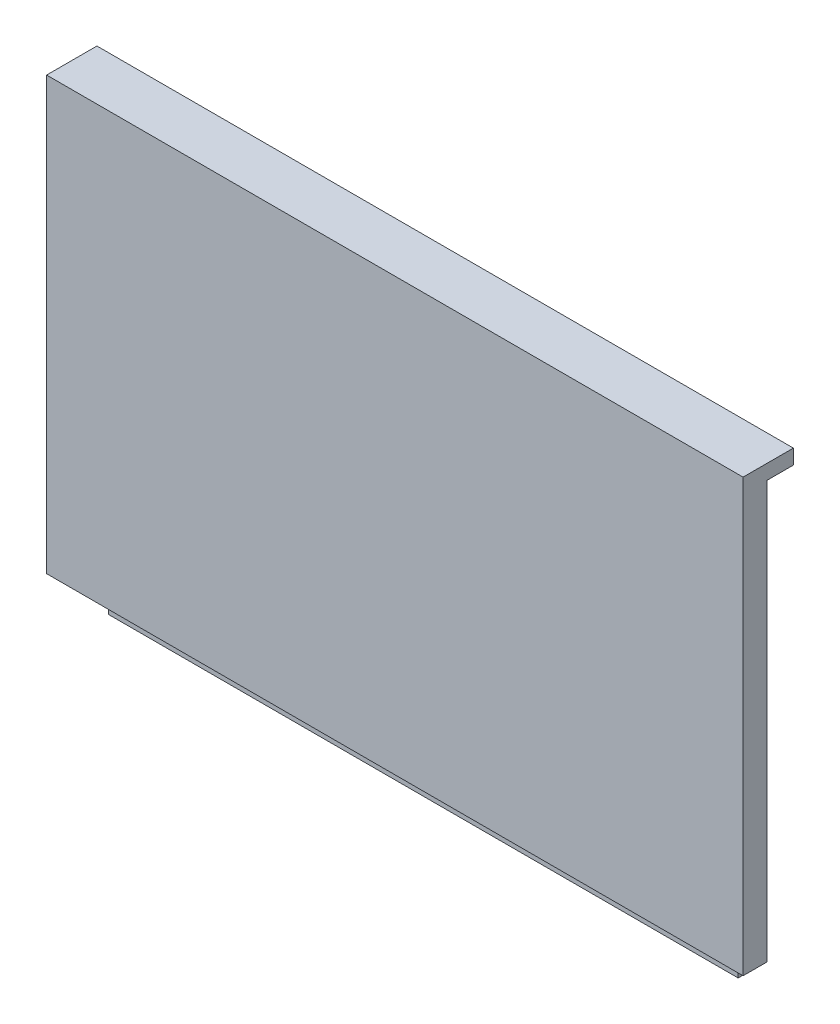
SolidWorks part; units mm, degrees
ref_plane "Front Plane" through (0, 0, 0) normal (0, 0, 1) x (1, 0, 0)
ref_plane "Top Plane" through (0, 0, 0) normal (0, 1, 0) x (1, 0, 0)
ref_plane "Right Plane" through (0, 0, 0) normal (1, 0, 0) x (0, 0, -1)
sketch "Sketch1" plane through (0, 0, 0) normal (0, 1, 0) x (1, 0, 0)
  line L1 (28.8, -1) -> (-28.8, -1)
  line L2 (28.8, -1) -> (28.8, 1)
  line L3 (28.8, 1) -> (-28.8, 1)
  line L4 (-28.8, -1) -> (-28.8, 1)
  line L5 (28.8, -1) -> (-28.8, 1) construction
  line L6 (28.8, 1) -> (-28.8, -1) construction
  point P0 (0, 0)
  dimension "D1" = 2
  dimension "D2" = 57.6
extrude "Boss-Extrude1" add sketch "Sketch1" along normal blind 42.5
sketch "Sketch2" plane through (0, 42.5, 0) normal (0, 1, 0) x (1, 0, 0)
  line L0 (28.8, 1) -> (-28.8, 1) construction
  line L1 (-28.8, -1) -> (28.8, -1)
  line L3 (-28.8, 1) -> (-28.8, -1) construction
  line L9 (-31.85, -2.5) -> (31.85, -2.5) construction
  line L12 (-28.8, -1.4) -> (-31.85, -1.4)
  line L13 (-31.85, -1.4) -> (-31.85, -3.6)
  line L14 (-31.85, -3.6) -> (-29.0686, -3.6)
  line L15 (28.9314, -3.6) -> (31.85, -3.6)
  line L16 (31.85, -3.6) -> (31.85, -1.4)
  line L17 (31.85, -1.4) -> (28.8, -1.4)
  line L18 (-28.8, -1) -> (-28.8, -1.4)
  line L20 (28.8, -1) -> (28.8, -1.4)
  line L22 (28.9314, -3.6) -> (-29.0686, -3.6)
  point P3 (0, -2.5)
  dimension "D2" = 2.2
  dimension "D1" = 3.5
  dimension "D3" = 3.05
extrude "Boss-Extrude2" add sketch "Sketch2" against normal offset from surface (39.5 mm away) 3
sketch "Sketch3" plane through (0, 42.5, 0) normal (0, 1, 0) x (1, 0, 0)
  line L0 (28.8, 1) -> (-28.8, 1) construction
  line L1 (-31.85, -3.6) -> (31.85, -3.6)
  line L2 (-31.85, -3.6) -> (-31.85, 1)
  line L3 (-31.85, 1) -> (31.85, 1)
  line L4 (31.85, -3.6) -> (31.85, 1)
  point P4 (31.85, -3.6)
extrude "Boss-Extrude3" add sketch "Sketch3" against normal blind 1.35
sketch "Sketch4" plane through (0, 0, -1) normal (0, 0, 1) x (1, 0, 0)
  line L0 (31.85, 3) -> (-31.85, 3) construction
  line L1 (-12.5, 13.7831) -> (12.5, 13.7831)
  line L2 (12.5, 13.7831) -> (0, 35.4338)
  line L3 (0, 35.4338) -> (-12.5, 13.7831)
  circle A0 centre (0, 21) radius 7.2169 construction
  point P1 (0, 0)
  point P7 (0, 21.0452)
  dimension "D1" = 25
  dimension "D2" = 18
extrude "Cut-Extrude1" cut sketch "Sketch4" along normal blind 1
